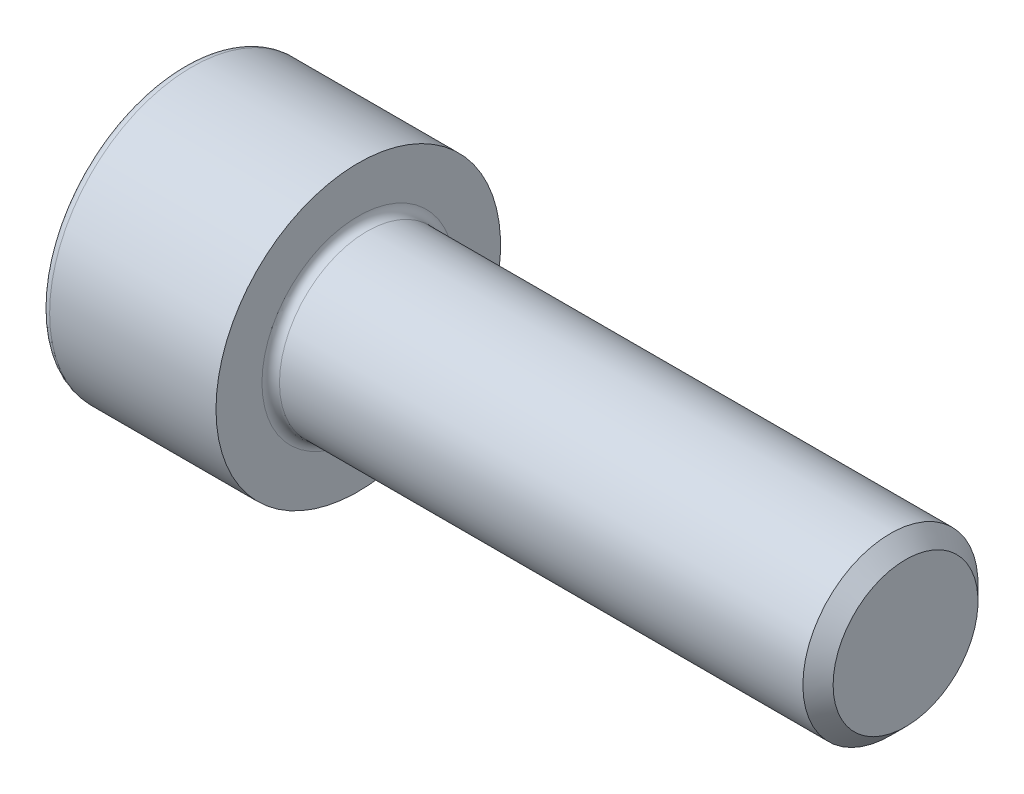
SolidWorks part; units mm, degrees
ref_plane "Plane1" through (0, 0, 0) normal (0, 0, 1) x (1, 0, 0)
ref_plane "Plane2" through (0, 0, 0) normal (0, 1, 0) x (1, 0, 0)
ref_plane "Plane3" through (0, 0, 0) normal (1, 0, 0) x (0, 0, -1)
sketch "BodySke" plane through (0, 0, 0) normal (0, 0, 1) x (1, 0, 0)
  line L0 (0, 0) -> (0, 6.5)
  line L1 (0, 6.5) -> (8, 6.5)
  line L2 (8, 6.5) -> (8, 4)
  line L3 (8, 4) -> (32.3095, 4)
  line L4 (33, 3.3095) -> (33, 0)
  line L5 (33, 0) -> (0, 0)
  line L6 (-31.75, 0) -> (127, 0) construction
  line L8 (33, 3.3095) -> (32.3095, 4)
  line L10 (33, -3.3095) -> (32.3095, -4) construction
  line L11 (9.25, 9.525) -> (9.25, 3.175) construction
  line L12 (8, 9.525) -> (8, 3.175) construction
  line L13 (-27, 9.525) -> (-27, 3.175) construction
  dimension "Diameter" = 8
  dimension "Head_ht" = 8
  dimension "Length" = 25
  dimension "Body_ch_ang" = 45
  dimension "Head_dia" = 13
  dimension "Minor_dia" = 6.619
  dimension "Advance" = 1.25
  dimension "Thread_nom" = 25
  dimension "Thread_length" = 60
revolve "Base-Revolve" add sketch "BodySke"
fillet "Fillet1" radius 0.4 1 edges at (8, 0, 4)
fillet "Fillet2" radius 0.4 1 edges at (0, 0, 6.5)
sketch "Sketch2" plane through (0, 0, 0) normal (0, 0, 1) x (1, 0, 0)
  line L0 (0, 3.0475) -> (4, 3.0475)
  line L1 (4, 3.0475) -> (5.7595, 0)
  line L2 (-31.75, 0) -> (127, 0) construction
  line L3 (5.7595, 0) -> (0, 0)
  line L4 (0, 0) -> (0, 3.0475)
  line L6 (0, 0) -> (47.625, 0) construction
  dimension "D1" = 3.0475
  dimension "D2" = 60
  dimension "Depth" = 4
revolve "Hex-PreBroach" cut sketch "Sketch2" angle 360 about L6
sketch "Sketch3" plane through (0, 0, 0) normal (-1, 0, 0) x (0, 0.5, 0.866)
  line L0 (1.7595, 3.0475) -> (-1.7595, 3.0475)
  line L1 (-1.7595, 3.0475) -> (-3.5189, 0)
  line L2 (1.7595, 3.0475) -> (3.5189, 0)
  line L3 (1.7595, -3.0475) -> (3.5189, 0)
  line L4 (1.7595, -3.0475) -> (-1.7595, -3.0475)
  line L5 (-1.7595, -3.0475) -> (-3.5189, 0)
  dimension "D1" = 3.0475
  dimension "D2" = 3.0475
  dimension "Hex_size" = 6.095
extrude "Hex" cut sketch "Sketch3" against normal blind 4
sketch "ThdSchSke" plane through (0, 0, 0) normal (0, 0, 1) x (1, 0, 0)
  line L0 (11.75, -3.3095) -> (11.2665, -4)
  line L1 (11.75, -3.3095) -> (12.2335, -4)
  line L2 (12.2335, -4) -> (12.2335, -5)
  line L3 (-3.175, 0) -> (5.1513, 0) construction
  line L4 (0, 6.1) -> (0, -6.1) construction
  line L5 (12.2335, -5) -> (11.2665, -5)
  line L6 (11.2665, -5) -> (11.2665, -4)
  dimension "Thread_minor" = 6.619
  dimension "Diameter" = 8
  dimension "Start" = 11.75
  dimension "SideAngle" = 55
  dimension "VeeAngle" = 70
  dimension "Overcut" = 10
revolve "ThreadSchematic" [suppressed] cut sketch "ThdSchSke" angle 360 about L3
pattern_linear "ThdSchPat" [suppressed]
equation "\"D2@Sketch3\" = \"Hex_size@Sketch3\" / 2"
equation "\"D1@Sketch3\" = \"Hex_size@Sketch3\" / 2"
equation "\"D1@Sketch2\" = \"Hex_size@Sketch3\" / 2"
equation "\"Thread_minor@ThreadCosmetic\"  =  \"Minor_dia@BodySke\""
equation "\"Depth@Sketch2\" =  \"Key_eng@Hex\""
equation "\"Thread_length@ThreadCosmetic\" = ((sgn( (\"Length@BodySke\" - \"Advance@BodySke\" * 3.0) - \"Thread_nom@BodySke\" )-1)*( (\"Length@BodySke\" - \"Advance@BodySke\" * 3.0) - \"Thread_nom@BodySke\" ))/-2+ \"Thread_no"
equation "\"Thread_minor@ThdSchSke\" = \"Minor_dia@BodySke\""
equation "\"Diameter@ThdSchSke\" = \"Diameter@BodySke\""
equation "\"Overcut@ThdSchSke\" = \"Diameter@BodySke\" * 1.25"
equation "\"Start@ThdSchSke\" = \"Head_ht@BodySke\" + \"Length@BodySke\" - \"Thread_length@ThreadCosmetic\"  '---Non-countersunk---"
equation "\"Num_threads@ThdSchPat\" = int( \"Thread_length@ThreadCosmetic\" / \"Advance@BodySke\" + 0.999 )  + 1"
equation "\"Advance@ThdSchPat\" = \"Thread_length@ThreadCosmetic\" /  (\"Num_threads@ThdSchPat\" - 1) 'relax it"
equation "\"Num_threads@ThdSchPat\" = \"Num_threads@ThdSchPat\" - sgn( \"Num_threads@ThdSchPat\" - 1) '---chamfered tips only---"
